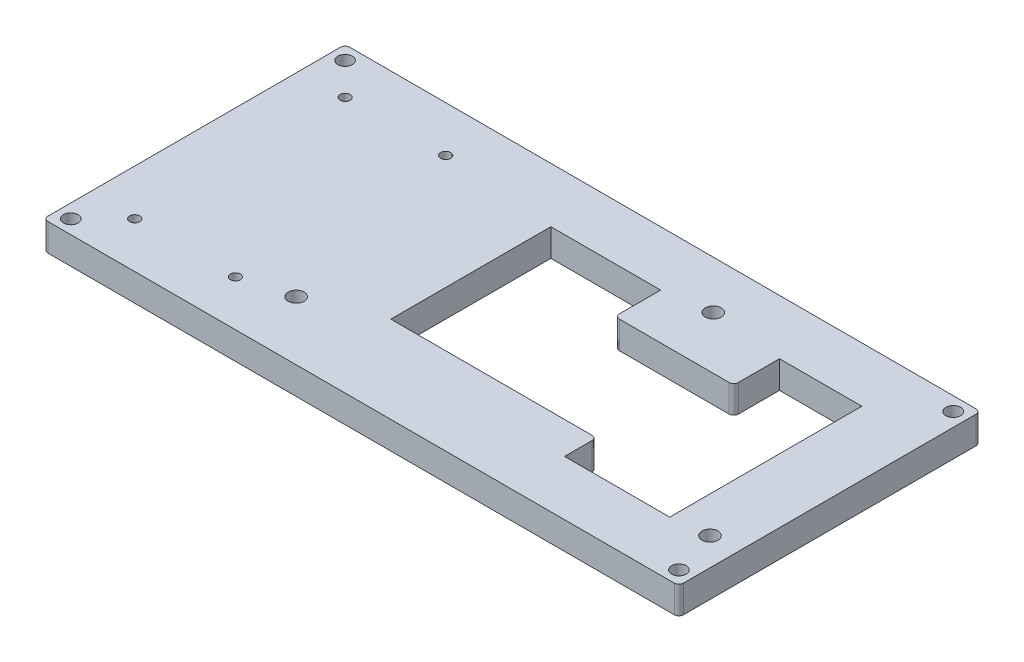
SolidWorks part; units mm, degrees
ref_plane "Plan de face" through (0, 0, 0) normal (0, 0, 1) x (1, 0, 0)
ref_plane "Plan de dessus" through (0, 0, 0) normal (0, 1, 0) x (1, 0, 0)
ref_plane "Plan de droite" through (0, 0, 0) normal (1, 0, 0) x (0, 0, -1)
sketch "Esquisse1" plane through (0, 0, 0) normal (0, 1, 0) x (1, 0, 0)
  line L0 (-17.0745, 0) -> (167.6594, 0) construction
  line L1 (1, 0) -> (138, 0)
  line L2 (0, 1) -> (0, 65)
  line L3 (1, 66) -> (138, 66)
  line L4 (139, 1) -> (139, 65)
  line L5 (0, -21.436) -> (0, 70.476) construction
  line L6 (-17.0745, 66) -> (167.6594, 66) construction
  line L7 (139, -21.436) -> (139, 70.476) construction
  line L8 (37.8593, 33) -> (157.4902, 33) construction
  line L9 (125, -9.2019) -> (125, 58.3756) construction
  line L10 (91, 26.367) -> (91, 60.265) construction
  line L11 (57, -9.2019) -> (57, 63) construction
  line L13 (-17.0745, 10) -> (35.0545, 10) construction
  line L14 (125, 12) -> (102, 12)
  line L15 (125, 12) -> (125, 54)
  line L16 (125, 54) -> (107, 54)
  line L18 (10, -9.2019) -> (10, 12.9067) construction
  line L19 (32, -9.2019) -> (32, 12.9067) construction
  line L20 (42.4, -9.2019) -> (42.4, 19.203) construction
  line L21 (39.0388, 12.9) -> (137.3835, 12.9) construction
  line L22 (39.0388, 53.1) -> (47.6679, 53.1) construction
  line L23 (41, 12) -> (143.1263, 12) construction
  line L24 (132.9, 6) -> (132.9, 37.5923) construction
  line L25 (-2.7611, 3) -> (141.5846, 3) construction
  line L26 (136, -3.848) -> (136, 6) construction
  line L27 (3, -3.1061) -> (3, 6) construction
  line L28 (41, 55) -> (41, 12) construction
  line L29 (90.3777, 55.5) -> (94.9736, 55.5) construction
  line L30 (41, 55) -> (133, 55) construction
  line L31 (133, 55) -> (133, 6) construction
  line L32 (143.1263, 44) -> (53.0863, 44) construction
  line L33 (81, 58.3756) -> (81, 43.2239) construction
  line L34 (107, 63) -> (107, 43.2239) construction
  line L35 (53.0863, 19) -> (105.6983, 19) construction
  line L36 (102, 20.6771) -> (102, 6.9702) construction
  line L37 (57, 19) -> (101, 19)
  line L38 (102, 12) -> (102, 18)
  line L39 (81, 54) -> (81, 45)
  line L40 (82, 44) -> (106, 44)
  line L41 (107, 45) -> (107, 54)
  line L42 (81, 54) -> (57, 54)
  line L44 (57, 19) -> (57, 54)
  circle A0 centre (32, 10) radius 1.1
  circle A1 centre (10, 10) radius 1.1
  circle A2 centre (10, 56) radius 1.1
  circle A3 centre (32, 56) radius 1.1
  circle A4 centre (42.4, 12.9) radius 1.75
  circle A5 centre (136, 3) radius 1.6
  circle A6 centre (132.9, 12.9) radius 1.75
  circle A7 centre (3, 3) radius 1.6
  circle A8 centre (136, 63) radius 1.6
  circle A10 centre (3, 63) radius 1.6
  arc A11 (1, 0) -> (0, 1) centre (1, 1) cw
  arc A12 (138, 0) -> (139, 1) centre (138, 1) ccw
  arc A13 (138, 66) -> (139, 65) centre (138, 65) cw
  arc A14 (0, 65) -> (1, 66) centre (1, 65) cw
  circle A15 centre (91, 55.5) radius 1.75
  arc A16 (102, 18) -> (101, 19) centre (101, 18) ccw
  arc A17 (106, 44) -> (107, 45) centre (106, 45) ccw
  arc A18 (81, 45) -> (82, 44) centre (82, 45) ccw
  point P26 (102, 19)
  point P73 (0, 0)
  point P76 (139, 0)
  point P79 (139, 66)
  point P82 (0, 66)
  point P106 (107, 44)
  point P112 (81, 44)
  dimension "D11" = 10.4
  dimension "D16" = 3
  dimension "D19" = 1
  dimension "D12" = 34
  dimension "D22" = 0.5
  dimension "D7" = 1
  dimension "D1" = 66
  dimension "D2" = 139
  dimension "D3" = 33
  dimension "D4" = 92
  dimension "D5" = 20.1
  dimension "D6" = 14
  dimension "D8" = 22
  dimension "D9" = 10
  dimension "D10" = 10
  dimension "D13" = 40.2
  dimension "D15" = 90.5
  dimension "D17" = 3
  dimension "D18" = 3
  dimension "D20" = 43
  dimension "D21" = 1.4
  dimension "D24" = 24
  dimension "D25" = 50
  dimension "D26" = 7
  dimension "D27" = 45
extrude "Boss.-Extru.1" add sketch "Esquisse1" along normal blind 6
sketch "Esquisse2" plane through (0, 0, 0) normal (0, -1, 0) x (1, 0, 0)
  circle A0 centre (132.9, -12.9) radius 3.5
  circle A1 centre (42.4, -12.9) radius 3.5
  circle A2 centre (91, -55.5) radius 3.5
extrude "Enlèv. mat.-Extru.1" cut sketch "Esquisse2" against normal blind 3
